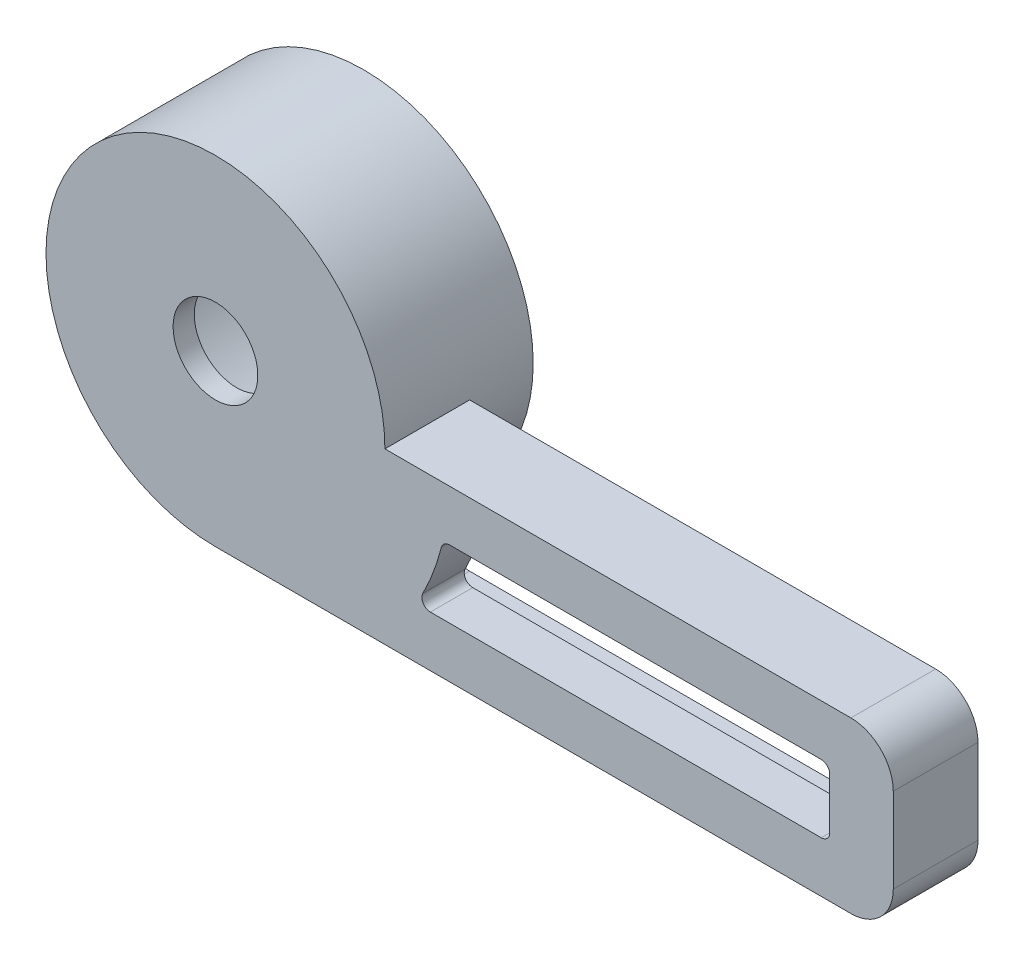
SolidWorks part; units mm, degrees
ref_plane "Plane1" through (0, 0, 0) normal (0, 0, 1) x (1, 0, 0)
ref_plane "Plane2" through (0, 0, 0) normal (0, 1, 0) x (1, 0, 0)
ref_plane "Plane3" through (0, 0, 0) normal (1, 0, 0) x (0, 0, -1)
sketch "Sketch1" plane through (0, 0, 0) normal (0, 0, 1) x (1, 0, 0)
  line L0 (90, -20) -> (-60, -20)
  line L1 (100, -10) -> (100, 10)
  line L2 (-60, 20) -> (90, 20)
  line L3 (-60, 20) -> (-60, -20)
  arc A0 (100, -10) -> (90, -20) centre (90, -10) cw
  arc A1 (90, 20) -> (100, 10) centre (90, 10) cw
  dimension "D1" = 10
extrude "Base-Extrude" add sketch "Sketch1" against normal blind 20
sketch "Sketch3" plane through (0, 0, 0) normal (0, 0, 1) x (1, 0, 0)
  circle A0 centre (-60, 20) radius 40
extrude "Boss-Extrude1" add sketch "Sketch3" against normal blind 35
sketch "Sketch4" plane through (0, 0, -35) normal (0, 0, -1) x (-1, 0, 0)
  circle A0 centre (60, 20) radius 35
  dimension "D1" = 70
extrude "Cut-Extrude1" cut sketch "Sketch4" against normal blind 30
sketch "Sketch5" plane through (0, 0, -20) normal (0, 0, -1) x (-1, 0, 0)
  line L10 (-90, -15) -> (60, -15)
  line L11 (-90, -15) -> (20, -15)
  line L12 (-95, -10) -> (-95, 10)
  line L13 (-95, -10) -> (-95, 10)
  line L14 (20, 15) -> (-90, 15)
  line L15 (11.0102, 15) -> (-90, 15)
  arc A4 (15, 20) -> (60, -25) centre (60, 20) ccw
  arc A5 (15.9092, 11) -> (24, -7) centre (60, 20) ccw
  arc A11 (24, -7) -> (20, -15) centre (20, -10) cw
  arc A12 (-95, -10) -> (-90, -15) centre (-90, -10) ccw
  arc A13 (-95, -10) -> (-90, -15) centre (-90, -10) ccw
  arc A14 (-90, 15) -> (-95, 10) centre (-90, 10) ccw
  arc A15 (-90, 15) -> (-95, 10) centre (-90, 10) ccw
  arc A16 (11.0102, 15) -> (15.9092, 11) centre (11.0102, 10) cw
  dimension "D7" = 5
  dimension "D1" = 5
  dimension "D2" = 5
  dimension "D3" = 5
  dimension "D4" = 5
  dimension "D5" = 5
  dimension "D6" = 5
extrude "Cut-Extrude2" cut sketch "Sketch5" against normal blind 10
sketch "Sketch6" plane through (0, 0, -5) normal (0, 0, -1) x (-1, 0, 0)
  circle A0 centre (60, 20) radius 10
  dimension "D1" = 20
extrude "Cut-Extrude3" cut sketch "Sketch6" against normal through all
sketch "Sketch8" plane through (0, 0, -10) normal (0, 0, -1) x (-1, 0, 0)
  line L1 (-90, -8) -> (20, -8)
  line L2 (-83, -8) -> (9.2753, -8)
  line L3 (11.0102, 8) -> (-90, 8)
  line L4 (4.746, 8) -> (-83, 8)
  line L5 (-85, -10) -> (-85, 10)
  line L6 (-85, -6) -> (-85, 6)
  arc A0 (-85, -6) -> (-83, -8) centre (-83, -6) ccw
  arc A1 (6.1112, 9) -> (16, -13) centre (60, 20) ccw
  arc A2 (6.6848, 6.4912) -> (11.0551, -5.0877) centre (60, 20) ccw
  arc A3 (-85, 6) -> (-83, 8) centre (-83, 6) cw
  arc A4 (4.746, 8) -> (6.6848, 6.4912) centre (4.746, 6) cw
  arc A5 (11.0551, -5.0877) -> (9.2753, -8) centre (9.2753, -6) cw
  dimension "D5" = 2
  dimension "D1" = 10
  dimension "D2" = 7
  dimension "D3" = 7
  dimension "D4" = 10
extrude "Cut-Extrude5" cut sketch "Sketch8" against normal through all
ref_plane "Stock Plane" through (0, 0, 5) normal (0, 0, 1) x (1, 0, 0)
sketch "Stock" plane through (0, 0, 5) normal (0, 0, 1) x (1, 0, 0)
  line L0 (-120, 80) -> (120, 80)
  line L1 (-120, 80) -> (-120, -40)
  line L2 (120, -40) -> (-120, -40)
  line L3 (120, -40) -> (120, 80)
ref_plane "Clamp Plane" through (0, 0, -40) normal (0, 0, -1) x (-1, 0, 0)
sketch "Clamp 1" plane through (0, 0, -40) normal (0, 0, -1) x (-1, 0, 0)
  line L0 (-120, 80) -> (-100, 80)
  line L1 (-120, 80) -> (-120, 60)
  line L2 (-100, 60) -> (-120, 60)
  line L3 (-100, 60) -> (-100, 80)
sketch "Clamp 2" plane through (0, 0, -40) normal (0, 0, -1) x (-1, 0, 0)
  line L1 (120, -40) -> (100, -40)
  line L2 (120, -40) -> (120, -20)
  line L3 (120, -20) -> (100, -20)
  line L4 (100, -40) -> (100, -20)
